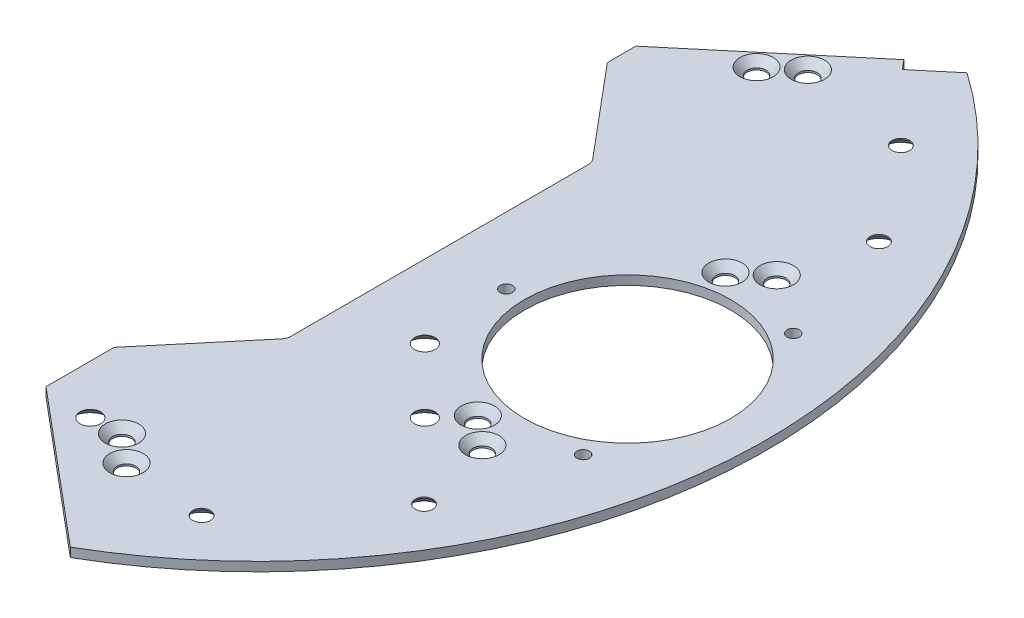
SolidWorks part; units mm, degrees
ref_plane "Plano frontal" through (0, 0, 0) normal (0, 0, 1) x (1, 0, 0)
ref_plane "Plano superior" through (0, 0, 0) normal (0, 1, 0) x (1, 0, 0)
ref_plane "Plano direito" through (0, 0, 0) normal (1, 0, 0) x (0, 0, -1)
sketch "Esboço1" plane through (0, 0, 0) normal (0, 1, 0) x (1, 0, 0)
  line L2 (0, 0) -> (17, 0) construction
  line L3 (17, -85.3229) -> (17, 85.3229)
  arc A0 (17, -85.3229) -> (17, 85.3229) centre (0, 0) ccw
  point P9 (17, 0)
  dimension "D1" = 174
  dimension "D2" = 17
extrude "Ressalto-extrusão1" add sketch "Esboço1" along normal blind 1.5 contours L3 A0
sketch "Esboço2" plane through (0, 1.5, 0) normal (0, 1, 0) x (1, 0, 0)
  line L0 (0, 0) -> (61, 0) construction
  line L1 (61, 0) -> (41, 0) construction
  line L2 (61, 0) -> (71, 17.3205) construction
  line L3 (61, 0) -> (71, -17.3205) construction
  circle A0 centre (61, 0) radius 17
  point P6 (41, 0)
  dimension "D2" = 34
  dimension "D1" = 61
  dimension "D3" = 20
  dimension "D4" = 3
extrude "Corte-extrusão1" cut sketch "Esboço2" against normal through all
hole_wizard "Furo roscado de M2.51" positions "3DSketch1" profile "Esboço3" tap size "M2.5" standard "ISO"
sketch3d "3DSketch1"
  point P0 (71, 1.5, 17.3205)
  point P3 (41, 1.5, 0)
  point P6 (71, 1.5, -17.3205)
sketch "Esboço3" plane through (71, 1.5, 17.3205) normal (1, 0, 0) x (0, 0, 1)
  line L0 (0, 0) -> (0, 1.5)
  line L1 (0, 1.5) -> (1.025, 1.5)
  line L2 (1.025, 1.5) -> (1.025, 0)
  line L5 (1.025, 0) -> (0, 0)
  line L11 (0, -6.35) -> (0, 107.95) construction
  dimension "Thru Tap Drill Dia." = 2.05
  dimension "Thru Tap Drill Depth" = 1.5
sketch "Esboço4" plane through (0, 1.5, 0) normal (0, 1, 0) x (1, 0, 0)
  line L0 (0, 0) -> (66.6459, 55.9225) construction
  line L1 (0, 0) -> (61, 0) construction
  line L2 (0, 0) -> (66.6459, -55.9225) construction
  line L3 (50.8976, 74.6906) -> (82.3942, 37.1544) construction
  line L4 (82.3942, 37.1544) -> (70.8874, 27.4991) construction
  line L5 (70.8874, 27.4991) -> (55.1391, 46.2672) construction
  line L6 (55.1391, 46.2672) -> (39.3908, 65.0353) construction
  line L7 (39.3908, 65.0353) -> (50.8976, 74.6906) construction
  line L8 (48.2004, 72.4274) -> (79.697, 34.8912) construction
  line L9 (50.8976, -74.6906) -> (82.3942, -37.1544) construction
  line L10 (82.3942, -37.1544) -> (70.8874, -27.4991) construction
  line L11 (70.8874, -27.4991) -> (39.3908, -65.0353) construction
  line L12 (39.3908, -65.0353) -> (50.8976, -74.6906) construction
  line L13 (63.9487, -53.6593) -> (79.697, -34.8912) construction
  line L14 (63.9487, -53.6593) -> (48.2004, -72.4274) construction
  line L15 (17, -85.3229) -> (17, 85.3229) construction
  line L16 (30, 0) -> (30, 24.445)
  line L17 (29.5321, 25.7306) -> (17, 40.6658)
  line L18 (30, 0) -> (30, -24.445)
  line L19 (29.5321, -25.7306) -> (17, -40.6658)
  line L20 (17, 40.6658) -> (17, -40.6658)
  arc A0 (17, -85.3229) -> (17, 85.3229) centre (0, 0) ccw construction
  arc A1 (30, 24.445) -> (29.5321, 25.7306) centre (28, 24.445) ccw
  arc A2 (30, -24.445) -> (29.5321, -25.7306) centre (28, -24.445) cw
  point P17 (66.6459, -55.9225)
  point P21 (66.6459, 55.9225)
  point P24 (17, 0)
  point P26 (30, 0)
  point P36 (30, 25.173)
  point P39 (30, -25.173)
  dimension "D8" = 2
  dimension "D1" = 40
  dimension "D2" = 40
  dimension "D3" = 49
  dimension "D4" = 11.5
  dimension "D5" = 49
  dimension "D6" = 11.5
  dimension "D7" = 30
extrude "Corte-extrusão2" cut sketch "Esboço4" against normal blind 2.5
sketch "Esboço5" plane through (0, 1.5, 0) normal (0, 1, 0) x (1, 0, 0)
  line L0 (41.7531, 62.2201) -> (68.5252, 30.3144) construction
  line L2 (70.8874, 27.4991) -> (55.1391, 46.2672) construction
  line L3 (41.7531, 62.2201) -> (29.956, 52.3212) construction
  line L4 (68.5252, 30.3144) -> (56.7281, 20.4154) construction
  line L5 (0, 0) -> (66.6459, -55.9225) construction
  line L6 (70.8874, -27.4991) -> (39.3908, -65.0353) construction
  line L7 (41.7531, -62.2201) -> (68.5252, -30.3144) construction
  line L8 (41.7531, -62.2201) -> (29.956, -52.3212) construction
  line L9 (68.5252, -30.3144) -> (56.7281, -20.4154) construction
  point P0 (34.5523, 56.1779)
  point P4 (55.1391, 46.2672)
  point P10 (61.3244, 24.2722)
  point P11 (55.1391, -46.2672)
  point P12 (61.3244, -24.2722)
  point P20 (55.1391, -46.2672)
  point P22 (34.5523, -56.1779)
  dimension "D1" = 41.65
  dimension "D2" = 9.4
  dimension "D3" = 6
  dimension "D4" = 6
  dimension "D5" = 9.4
  dimension "D6" = 41.65
  dimension "D7" = 9.4
  dimension "D8" = 6
  dimension "D9" = 6
  dimension "D10" = 9.4
hole_wizard "Escareado para parafuso com cabeça escareada chata de M2.51" positions "3DSketch2" profile "Esboço6" countersink size "M2.5" standard "ISO"
sketch3d "3DSketch2"
  point P0 (34.5523, 1.5, -56.1779)
  point P3 (29.956, 1.5, -52.3212)
  point P6 (61.3244, 1.5, -24.2722)
  point P9 (56.7281, 1.5, -20.4154)
sketch "Esboço6" plane through (34.5523, 1.5, -56.1779) normal (1, 0, 0) x (0, 0, 1)
  line L0 (0, 0) -> (0, 1.5)
  line L1 (0, 1.5) -> (1.55, 1.5)
  line L2 (1.55, 1.5) -> (1.55, 1.2)
  line L3 (1.55, 1.2) -> (2.75, 0)
  line L5 (2.75, 0) -> (0, 0)
  line L6 (-1.55, 1.2) -> (-2.75, 0) construction
  line L11 (0, -6.35) -> (0, 107.95) construction
  dimension "Thru Hole Dia." = 3.1
  dimension "Thru Hole Depth" = 1.5
  dimension "Near C'Sink Dia." = 5.5
  dimension "Near C'Sink Angle" = 90
hole_wizard "Escareado para parafuso com cabeça escareada chata de M2.52" positions "3DSketch3" profile "Esboço7" countersink size "M2.5" standard "ISO"
sketch3d "3DSketch3"
  point P0 (56.7281, 1.5, 20.4154)
  point P3 (61.3244, 1.5, 24.2722)
  point P6 (29.956, 1.5, 52.3212)
  point P9 (34.5523, 1.5, 56.1779)
sketch "Esboço7" plane through (56.7281, 1.5, 20.4154) normal (1, 0, 0) x (0, 0, 1)
  line L0 (0, 0) -> (0, 1.5)
  line L1 (0, 1.5) -> (1.55, 1.5)
  line L2 (1.55, 1.5) -> (1.55, 1.2)
  line L3 (1.55, 1.2) -> (2.75, 0)
  line L5 (2.75, 0) -> (0, 0)
  line L6 (-1.55, 1.2) -> (-2.75, 0) construction
  line L11 (0, -6.35) -> (0, 107.95) construction
  dimension "Thru Hole Dia." = 3.1
  dimension "Thru Hole Depth" = 1.5
  dimension "Near C'Sink Dia." = 5.5
  dimension "Near C'Sink Angle" = 90
sketch "Esboço8" plane through (0, 1.5, 0) normal (0, 1, 0) x (1, 0, 0)
  line L0 (0, 0) -> (0, 87) construction
  line L1 (27.5, 80) -> (34.1906, 80)
  line L2 (34.1906, 80) -> (34.1906, 87)
  line L3 (34.1906, 87) -> (0, 87)
  line L4 (0, 87) -> (0, 80)
  line L5 (0, 55) -> (27.5, 55)
  line L6 (27.5, 55) -> (27.5, 80)
  line L7 (0, 80) -> (27.5, 80) construction
  line L8 (0, 80) -> (0, 55)
  arc A1 (17, -85.3229) -> (17, 85.3229) centre (0, 0) ccw construction
  point P3 (0, 80)
  point P14 (27.5, 80)
  dimension "D1" = 87
  dimension "D2" = 80
  dimension "D3" = 27.5
  dimension "D4" = 25
sketch "Esboço10" plane through (0, 0, 0) normal (0, -1, 0) x (1, 0, 0)
  line L0 (0, 0) -> (78, 0) construction
  line L1 (0, 0) -> (64.9519, -37.5) construction
  line L2 (0, 0) -> (64.9519, 37.5) construction
  line L3 (0, 0) -> (48.2091, 57.4533) construction
  line L4 (0, 0) -> (53.033, -53.033) construction
  circle A0 centre (61, 0) radius 17 construction
  dimension "D1" = 30
  dimension "D2" = 45
  dimension "D3" = 50
  dimension "D4" = 30
  dimension "D5" = 75
hole_wizard "Escareado para parafuso com cabeça escareada chata de M2.53" positions "3DSketch4" profile "Esboço11" countersink size "M2.5" standard "ISO"
sketch3d "3DSketch4"
  point P0 (48.2091, 0, 57.4533)
  point P3 (64.9519, 0, 37.5)
  point P6 (64.9519, 0, -37.5)
  point P9 (53.033, 0, -53.033)
sketch "Esboço11" plane through (48.2091, 0, 57.4533) normal (1, 0, 0) x (0, 0, -1)
  line L0 (0, 0) -> (0, 8.1212)
  line L1 (0, 8.1212) -> (1.45, 7.25)
  line L2 (1.45, 7.25) -> (1.45, 1.3)
  line L3 (1.45, 1.3) -> (2.75, 0)
  line L5 (2.75, 0) -> (0, 0)
  line L6 (-1.45, 1.3) -> (-2.75, 0) construction
  line L10 (0, 8.1212) -> (-1.45, 7.25) construction
  line L11 (0, -6.35) -> (0, 107.95) construction
  dimension "Hole Dia." = 2.9
  dimension "Hole Depth" = 7.25
  dimension "Near C'Sink Dia." = 5.5
  dimension "Near C'Sink Angle" = 90
  dimension "Drill Angle" = 118
sketch "Esboço15" plane through (0, 0, 0) normal (0, -1, 0) x (1, 0, 0)
  line L0 (0, 0) -> (42.4264, 42.4264) construction
  line L1 (0, 0) -> (61, 0)
  line L2 (58.3363, 26.5165) -> (26.5165, 58.3363)
  line L3 (58.3363, 26.5165) -> (40.6586, 8.8388)
  line L4 (40.6586, 8.8388) -> (8.8388, 40.6586)
  line L5 (8.8388, 40.6586) -> (26.5165, 58.3363)
  point P2 (25.1023, 52.6795)
  point P6 (42.4264, 42.4264)
  point P9 (14.4957, 42.0729)
  point P10 (42.0729, 14.4957)
  point P14 (52.6795, 25.1023)
  dimension "D1" = 45
  dimension "D2" = 60
  dimension "D3" = 45
  dimension "D4" = 25
  dimension "D5" = 3
  dimension "D6" = 3
  dimension "D7" = 3
  dimension "D8" = 5
  dimension "D9" = 5
  dimension "D10" = 20
  dimension "D11" = 3
  dimension "D12" = 5
hole_wizard "Escareado para parafuso com cabeça escareada chata de M31" positions "3DSketch5" profile "Esboço16" countersink size "M3" standard "ISO"
sketch3d "3DSketch5"
  point P0 (42.0729, 0, 14.4957)
  point P3 (52.6795, 0, 25.1023)
  point P6 (25.1023, 0, 52.6795)
sketch "Esboço16" plane through (42.0729, 0, 14.4957) normal (1, 0, 0) x (0, 0, -1)
  line L0 (0, 0) -> (0, 6.0215)
  line L1 (0, 6.0215) -> (1.7, 5)
  line L2 (1.7, 5) -> (1.7, 1.45)
  line L3 (1.7, 1.45) -> (3.15, 0)
  line L5 (3.15, 0) -> (0, 0)
  line L6 (-1.7, 1.45) -> (-3.15, 0) construction
  line L10 (0, 6.0215) -> (-1.7, 5) construction
  line L11 (0, -6.35) -> (0, 107.95) construction
  dimension "Hole Dia." = 3.4
  dimension "Hole Depth" = 5
  dimension "Near C'Sink Dia." = 6.3
  dimension "Near C'Sink Angle" = 90
  dimension "Drill Angle" = 118
sketch "Esboço17" plane through (0, 0, 0) normal (0, -1, 0) x (1, 0, 0)
  line L0 (29.956, -52.3212) -> (34.5523, -56.1779) construction
  line L1 (29.956, -52.3212) -> (28.0276, -54.6193) construction
  line L2 (28.0276, -54.6193) -> (17, -45.366)
  line L4 (17, -40.6658) -> (17, -85.3229) construction
  line L5 (17, -45.366) -> (17, -85.3229)
  line L6 (28.0276, -54.6193) -> (48.7837, -72.0357)
  line L7 (48.7837, -72.0357) -> (48.7837, -85.3229)
  line L8 (48.7837, -85.3229) -> (17, -85.3229)
  arc A0 (17, -85.3229) -> (17, 85.3229) centre (0, 0) ccw construction
  dimension "D1" = 3
extrude "Corte-extrusão3" cut sketch "Esboço17" against normal through all
sketch "Esboço18" plane through (0, 1.5, 0) normal (0, 1, 0) x (1, 0, 0)
  line L0 (34.5523, -56.1779) -> (29.956, -52.3212) construction
  line L1 (29.956, -52.3212) -> (24.8137, -58.4495) construction
  line L2 (24.8137, -58.4495) -> (17, -51.8931)
  line L3 (17, -85.3229) -> (17, -40.6658) construction
  line L4 (17, -51.8931) -> (17, -85.3229)
  line L5 (17, -85.3229) -> (56.8402, -85.3229)
  line L6 (56.8402, -85.3229) -> (24.8137, -58.4495)
  dimension "D1" = 8
extrude "Corte-extrusão4" cut sketch "Esboço18" against normal through all contours L5 L6 L2 L4
sketch "Esboço19" plane through (0, 1.5, 0) normal (0, 1, 0) x (1, 0, 0)
  line L0 (48.7837, 72.0357) -> (17, 45.366) construction
  line L1 (44.3532, -74.8451) -> (17, -51.8931) construction
  line L2 (48.7837, 72.0357) -> (46.3908, 70.0278)
  line L3 (41.9121, -72.7968) -> (44.3532, -74.8451)
  arc A0 (44.3532, -74.8451) -> (48.7837, 72.0357) centre (0, 0) ccw
  arc A1 (44.3532, -74.8451) -> (48.7837, 72.0357) centre (0, 0) ccw construction
  arc A2 (46.3908, 70.0278) -> (41.9121, -72.7968) centre (0, 0) cw
  dimension "D1" = 84
extrude "Corte-extrusão5" cut sketch "Esboço19" against normal through all
sketch "Esboço20" plane through (0, 1.5, 0) normal (0, 1, 0) x (1, 0, 0)
  line L0 (41.0285, 65.5283) -> (42.314, 63.9962)
  line L1 (46.3908, 70.0278) -> (17, 45.366) construction
  line L2 (42.314, 63.9962) -> (48.109, 68.8587)
  line L3 (41.0285, 65.5283) -> (46.8234, 70.3908)
  line L4 (48.109, 68.8587) -> (46.8234, 70.3908)
  arc A0 (41.9121, -72.7968) -> (46.3908, 70.0278) centre (0, 0) ccw construction
  dimension "D1" = 2
  dimension "D2" = 7
extrude "Corte-extrusão6" cut sketch "Esboço20" against normal through all
